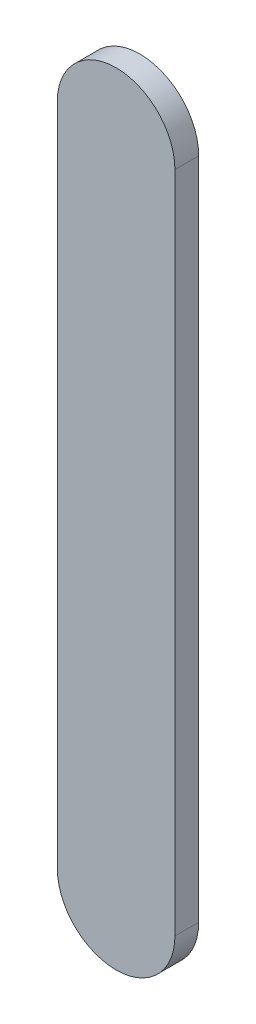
SolidWorks part; units mm, degrees
ref_plane "Face" through (0, 0, 0) normal (0, 0, 1) x (1, 0, 0)
ref_plane "Dessus" through (0, 0, 0) normal (0, 1, 0) x (1, 0, 0)
ref_plane "Droite" through (0, 0, 0) normal (1, 0, 0) x (0, 0, -1)
sketch "Esquisse1" plane through (0, 0, 0) normal (0, 0, 1) x (1, 0, 0)
  line L0 (0, 0) -> (0, -419) construction
  line L1 (-37.13, 0) -> (-37.13, -419)
  line L2 (37.13, 0) -> (37.13, -419)
  arc A0 (37.13, 0) -> (-37.13, 0) centre (0, 0) ccw
  arc A1 (-37.13, -419) -> (37.13, -419) centre (0, -419) ccw
  dimension "D2" = 74.26
  dimension "D1" = 419
extrude "Extrusion1" add sketch "Esquisse1" along normal blind 15
sketch "Esquisse2" plane through (0, 0, 15) normal (0, 0, 1) x (1, 0, 0)
  point P0 (0, -419)
  point P1 (0, 0)
